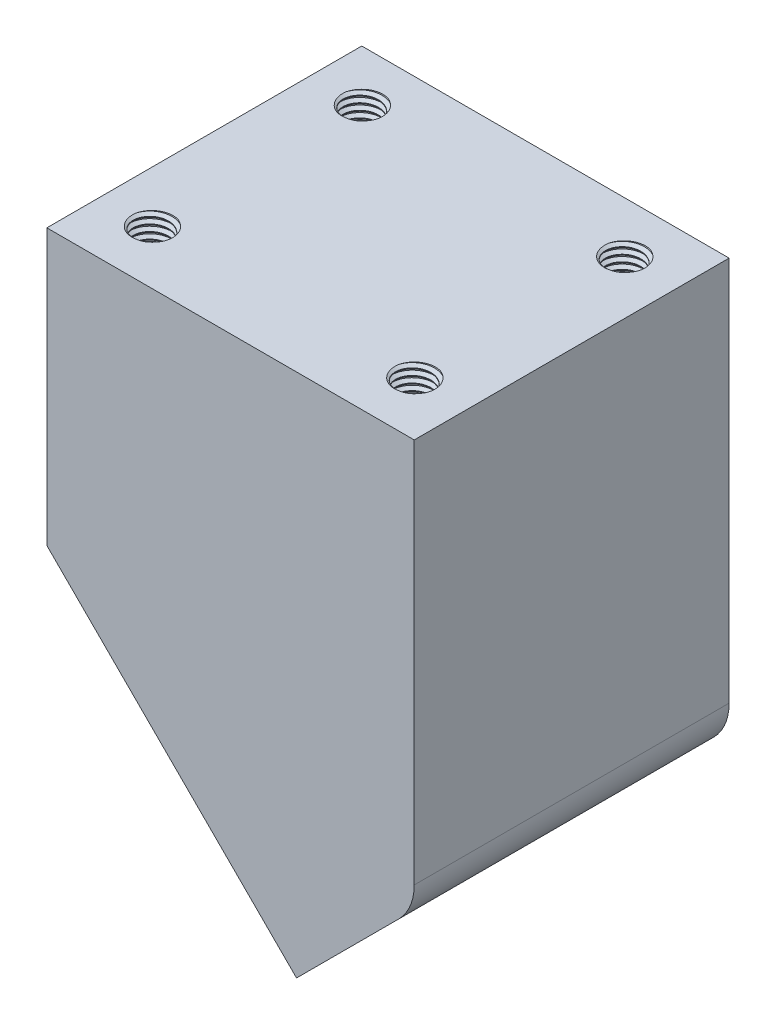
SolidWorks part; units mm, degrees
ref_plane "Front Plane" through (0, 0, 0) normal (0, 0, 1) x (1, 0, 0)
ref_plane "Top Plane" through (0, 0, 0) normal (0, 1, 0) x (1, 0, 0)
ref_plane "Right Plane" through (0, 0, 0) normal (1, 0, 0) x (0, 0, -1)
sketch "Sketch1" plane through (0, 0, 0) normal (0, 0, 1) x (1, 0, 0)
  line L0 (0, 0) -> (-47.574, 47.574)
  line L1 (-47.574, 47.574) -> (-47.574, 100)
  line L2 (-47.574, 100) -> (22.426, 100)
  line L3 (22.426, 100) -> (22.426, 22.426)
  line L4 (22.426, 22.426) -> (0, 0)
  dimension "D1" = 135
  dimension "D2" = 90
  dimension "D3" = 70
  dimension "D4" = 100
extrude "Boss-Extrude1" add sketch "Sketch1" along normal blind 60
fillet "Fillet1" radius 10 1 edges at (22.426, 22.426, 30)
sketch "Sketch11" plane through (0, 100, 0) normal (0, 1, 0) x (1, 0, 0)
  line L0 (22.426, 0) -> (-47.574, 0) construction
  line L1 (-47.574, -60) -> (-47.574, 0) construction
  line L2 (22.426, -60) -> (-47.574, -60) construction
  line L3 (22.426, -60) -> (22.426, 0) construction
  circle A0 centre (-37.574, -10) radius 3.375
  circle A1 centre (-37.574, -50) radius 3.375
  circle A2 centre (12.426, -50) radius 3.375
  circle A3 centre (12.426, -10) radius 3.375
  dimension "D1" = 10
  dimension "D2" = 10
  dimension "D5" = 6.75
  dimension "D3" = 10
  dimension "D4" = 10
extrude "Cut-Extrude2" cut sketch "Sketch11" against normal blind 15
thread "Thread5" pitch 1.25 start angle 0, offset 2, length 15, pitch 1.25, diameter 6.75
ref_plane "Plane6" through (9.051, 102, 10) normal (0, 0, 1) x (-1, 0, 0)
sketch "Thread Profile5" plane through (9.051, 102, 10) normal (0, 0, 1) x (-1, 0, 0)
  line L0 (0, 0) -> (0, 1.25) construction
  line L11 (0, 1.0938) -> (0, 0)
  line L12 (0, 0) -> (0.6766, 0.3906)
  line L13 (0.6766, 0.3906) -> (0.6766, 0.7031)
  line L15 (0.6766, 0.7031) -> (0, 1.0938)
  line L17 (0.6766, 0.5469) -> (0, 0.5469) construction
  point P3 (0, 0)
  dimension "Pitch" = 1.25
  dimension "Profile_Angle" = 60
  dimension "Profile_Land" = 0.3125
  dimension "Profile_Height" = 0.6766
thread "Thread6" pitch 1.25 start angle 0, offset 2, length 15, pitch 1.25, diameter 6.75
ref_plane "Plane7" through (-40.949, 102, 10) normal (0, 0, 1) x (-1, 0, 0)
sketch "Thread Profile6" plane through (-40.949, 102, 10) normal (0, 0, 1) x (-1, 0, 0)
  line L0 (0, 0) -> (0, 1.25) construction
  line L11 (0, 1.0938) -> (0, 0)
  line L12 (0, 0) -> (0.6766, 0.3906)
  line L13 (0.6766, 0.3906) -> (0.6766, 0.7031)
  line L15 (0.6766, 0.7031) -> (0, 1.0938)
  line L17 (0.6766, 0.5469) -> (0, 0.5469) construction
  point P3 (0, 0)
  dimension "Pitch" = 1.25
  dimension "Profile_Angle" = 60
  dimension "Profile_Land" = 0.3125
  dimension "Profile_Height" = 0.6766
thread "Thread7" pitch 1.25 start angle 0, offset 2, length 15, pitch 1.25, diameter 6.75
ref_plane "Plane8" through (-40.949, 102, 50) normal (0, 0, 1) x (-1, 0, 0)
sketch "Thread Profile7" plane through (-40.949, 102, 50) normal (0, 0, 1) x (-1, 0, 0)
  line L0 (0, 0) -> (0, 1.25) construction
  line L11 (0, 1.0938) -> (0, 0)
  line L12 (0, 0) -> (0.6766, 0.3906)
  line L13 (0.6766, 0.3906) -> (0.6766, 0.7031)
  line L15 (0.6766, 0.7031) -> (0, 1.0938)
  line L17 (0.6766, 0.5469) -> (0, 0.5469) construction
  point P3 (0, 0)
  dimension "Pitch" = 1.25
  dimension "Profile_Angle" = 60
  dimension "Profile_Land" = 0.3125
  dimension "Profile_Height" = 0.6766
thread "Thread8" pitch 1.25 start angle 0, offset 2, length 15, pitch 1.25, diameter 6.75
ref_plane "Plane9" through (9.051, 102, 50) normal (0, 0, 1) x (-1, 0, 0)
sketch "Thread Profile8" plane through (9.051, 102, 50) normal (0, 0, 1) x (-1, 0, 0)
  line L0 (0, 0) -> (0, 1.25) construction
  line L11 (0, 1.0938) -> (0, 0)
  line L12 (0, 0) -> (0.6766, 0.3906)
  line L13 (0.6766, 0.3906) -> (0.6766, 0.7031)
  line L15 (0.6766, 0.7031) -> (0, 1.0938)
  line L17 (0.6766, 0.5469) -> (0, 0.5469) construction
  point P3 (0, 0)
  dimension "Pitch" = 1.25
  dimension "Profile_Angle" = 60
  dimension "Profile_Land" = 0.3125
  dimension "Profile_Height" = 0.6766
sketch "Sketch12" plane through (0, 0, 0) normal (-0.7071, -0.7071, 0) x (-0.7071, 0.7071, 0)
  point P6 (50.4598, -30)
  point P8 (16.8199, -30)
sketch "Sketch14" plane through (0, 0, 0) normal (-0.7071, -0.7071, 0) x (0, 0, 1)
  circle A0 centre (30, 50.4598) radius 3.375
  circle A1 centre (30, 16.8199) radius 3.375
  dimension "D1" = 6.75
  dimension "D2" = 6.75
extrude "Cut-Extrude3" cut sketch "Sketch14" against normal blind 15
thread "Thread9" pitch 1.25 start angle 0, offset 1, length 15, pitch 1.25, diameter 6.75
ref_plane "Plane10" through (-34.0011, 32.5869, 30) normal (0, 0, 1) x (0.7071, -0.7071, 0)
sketch "Thread Profile9" plane through (-34.0011, 32.5869, 30) normal (0, 0, 1) x (0.7071, -0.7071, 0)
  line L0 (0, 0) -> (0, 1.25) construction
  line L11 (0, 1.0938) -> (0, 0)
  line L12 (0, 0) -> (0.6766, 0.3906)
  line L13 (0.6766, 0.3906) -> (0.6766, 0.7031)
  line L15 (0.6766, 0.7031) -> (0, 1.0938)
  line L17 (0.6766, 0.5469) -> (0, 0.5469) construction
  point P3 (0, 0)
  dimension "Pitch" = 1.25
  dimension "Profile_Angle" = 60
  dimension "Profile_Land" = 0.3125
  dimension "Profile_Height" = 0.6766
thread "Thread10" pitch 1.25 start angle 0, offset 1, length 15, pitch 1.25, diameter 6.75
ref_plane "Plane11" through (-10.2141, 8.7999, 30) normal (0, 0, 1) x (0.7071, -0.7071, 0)
sketch "Thread Profile10" plane through (-10.2141, 8.7999, 30) normal (0, 0, 1) x (0.7071, -0.7071, 0)
  line L0 (0, 0) -> (0, 1.25) construction
  line L11 (0, 1.0938) -> (0, 0)
  line L12 (0, 0) -> (0.6766, 0.3906)
  line L13 (0.6766, 0.3906) -> (0.6766, 0.7031)
  line L15 (0.6766, 0.7031) -> (0, 1.0938)
  line L17 (0.6766, 0.5469) -> (0, 0.5469) construction
  point P3 (0, 0)
  dimension "Pitch" = 1.25
  dimension "Profile_Angle" = 60
  dimension "Profile_Land" = 0.3125
  dimension "Profile_Height" = 0.6766
